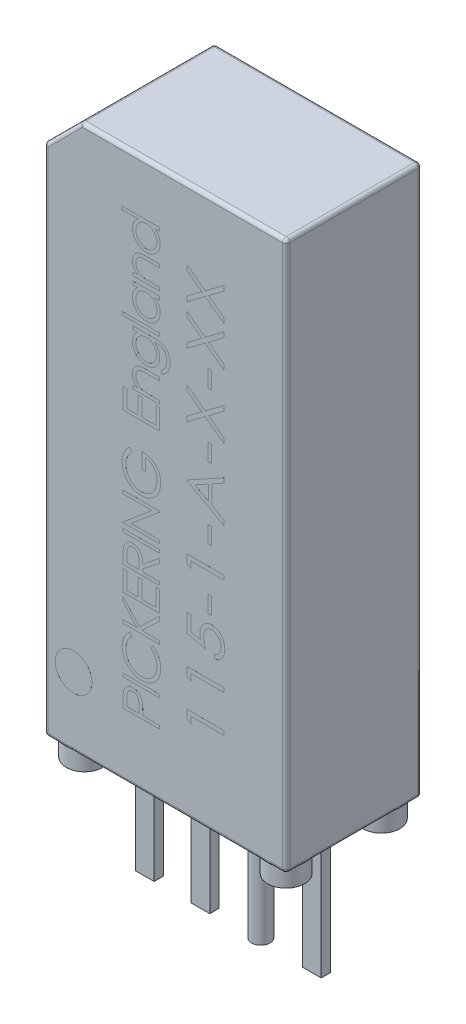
SolidWorks part; units mm, degrees
ref_plane "Front Plane" through (0, 0, 0) normal (0, 0, 1) x (1, 0, 0)
ref_plane "Top Plane" through (0, 0, 0) normal (0, 1, 0) x (1, 0, 0)
ref_plane "Right Plane" through (0, 0, 0) normal (1, 0, 0) x (0, 0, -1)
sketch "Sketch1" plane through (0, 0, 0) normal (0, 1, 0) x (1, 0, 0)
  line L1 (3.3, -1.85) -> (-3.3, -1.85)
  line L2 (3.3, -1.85) -> (3.3, 1.85)
  line L3 (3.3, 1.85) -> (-3.3, 1.85)
  line L4 (-3.3, -1.85) -> (-3.3, 1.85)
  line L5 (3.3, -1.85) -> (-3.3, 1.85) construction
  line L6 (3.3, 1.85) -> (-3.3, -1.85) construction
  point P0 (0, 0)
  dimension "D1" = 3.7
  dimension "D2" = 6.6
extrude "Main body" add sketch "Sketch1" along normal blind 14.992
sketch "Sketch2" plane through (0, 0, 1.85) normal (0, 0, 1) x (1, 0, 0)
  line L0 (-2.3, 14.992) -> (-3.3, 13.992)
  line L1 (-3.3, 14.992) -> (3.3, 14.992) construction
  line L2 (-3.3, 14.992) -> (-3.3, 0) construction
  line L3 (-3.3, 13.992) -> (-3.3, 14.992)
  line L4 (-3.3, 14.992) -> (-2.3, 14.992)
  dimension "D1" = 45
  dimension "D2" = 5.6
extrude "Box style cut" cut sketch "Sketch2" against normal through all
sketch "Sketch3" plane through (0, 0, 0) normal (0, -1, 0) x (1, 0, 0)
  line L0 (-3.3, 1.85) -> (3.3, 1.85) construction
  line L1 (-3.3, -1.85) -> (-3.3, 1.85) construction
  line L2 (3.3, -1.85) -> (-3.3, -1.85) construction
  line L3 (3.3, 1.85) -> (3.3, -1.85) construction
  circle A0 centre (-2.75, 1.3) radius 0.5
  circle A1 centre (-2.75, -1.3) radius 0.5
  circle A2 centre (2.75, -1.3) radius 0.5
  circle A3 centre (2.75, 1.3) radius 0.5
  dimension "D1" = 1
  dimension "D4" = 1
  dimension "D7" = 1
  dimension "D9" = 1
  dimension "D2" = 0.55
  dimension "D3" = 0.55
  dimension "D5" = 0.55
  dimension "D6" = 0.55
  dimension "D8" = 0.55
extrude "Feet" add sketch "Sketch3" along normal blind 0.508
sketch "Sketch4" plane through (0, 0, 0) normal (0, -1, 0) x (1, 0, 0)
  line L0 (-3.3, -1.85) -> (-3.3, 1.85) construction
  line L1 (-2.026, -0.127) -> (-2.534, -0.127)
  line L2 (-2.026, -0.127) -> (-2.026, 0.127)
  line L3 (-2.026, 0.127) -> (-2.534, 0.127)
  line L4 (-2.534, -0.127) -> (-2.534, 0.127)
  line L5 (-2.026, -0.127) -> (-2.534, 0.127) construction
  line L6 (-2.026, 0.127) -> (-2.534, -0.127) construction
  line L13 (-0.506, -0.127) -> (-1.014, -0.127)
  line L14 (-0.506, -0.127) -> (-0.506, 0.127)
  line L15 (-0.506, 0.127) -> (-1.014, 0.127)
  line L16 (-1.014, -0.127) -> (-1.014, 0.127)
  line L17 (-0.506, -0.127) -> (-1.014, 0.127) construction
  line L18 (-0.506, 0.127) -> (-1.014, -0.127) construction
  line L19 (2.534, -0.127) -> (2.026, -0.127)
  line L20 (2.534, -0.127) -> (2.534, 0.127)
  line L21 (2.534, 0.127) -> (2.026, 0.127)
  line L22 (2.026, -0.127) -> (2.026, 0.127)
  line L23 (2.534, -0.127) -> (2.026, 0.127) construction
  line L24 (2.534, 0.127) -> (2.026, -0.127) construction
  circle A0 centre (0.76, 0) radius 0.25
  point P0 (-2.28, 0)
  point P10 (-0.76, 0)
  point P15 (2.28, 0)
  dimension "D3" = 0.5
  dimension "D1" = 0.508
  dimension "D2" = 0.254
  dimension "D4" = 1.52
  dimension "D5" = 0.508
  dimension "D6" = 0.254
  dimension "D7" = 0.508
  dimension "D8" = 0.254
  dimension "D9" = 1.52
  dimension "D10" = 1.52
  dimension "D12" = 1.02
extrude "Pins" add sketch "Sketch4" along normal blind 3.678
sketch "Sketch5"
  dimension "D5" = 1
  dimension "D1" = 12
  dimension "D2" = 1.4
  dimension "D3" = 3.15
  dimension "D4" = 1.75
  dimension "D6" = 1.9
  dimension "D7" = 0.8
extrude "Lettering" add sketch "Sketch5" along normal blind 0.0001
fillet "Fillet1" radius 0.1 15 edges at (0.5, 14.992, 1.85) (-2.3, 14.992, 0) (-2.8, 14.492, 1.85) (3.3, 7.496, 1.85) (3.3, 14.992, 0) (3.3, 0, 0) (0, 0, -1.85) (3.3, 7.496, -1.85) (0.5, 14.992, -1.85) (-2.8, 14.492, -1.85) (-3.3, 0, 0) (-3.3, 6.996, -1.85) (-3.3, 13.992, 0) (-3.3, 6.996, 1.85) (0, 0, 1.85)
